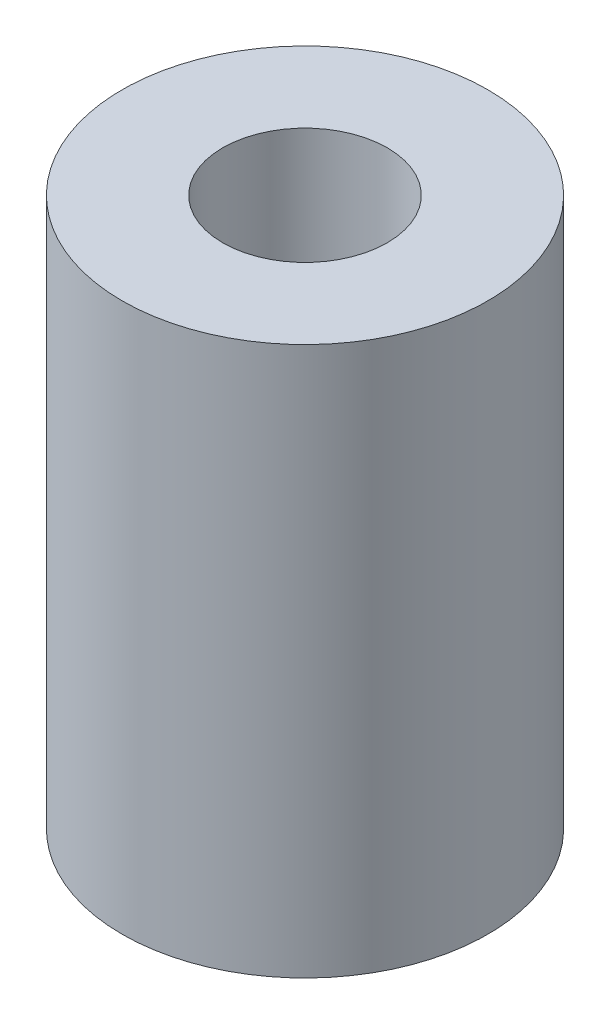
SolidWorks part; units mm, degrees
ref_plane "Plan1" through (0, 0, 0) normal (0, 0, 1) x (1, 0, 0)
ref_plane "Plan2" through (0, 0, 0) normal (0, 1, 0) x (1, 0, 0)
ref_plane "Plan3" through (0, 0, 0) normal (1, 0, 0) x (0, 0, -1)
sketch "Esquisse1" plane through (0, 0, 0) normal (0, 0, 1) x (1, 0, 0)
  line L0 (0, 0) -> (0, 94.989) construction
  line L1 (2.25, 15) -> (2.25, 0)
  line L2 (2.25, 0) -> (5, 0)
  line L3 (5, 0) -> (5, 15)
  line L4 (5, 15) -> (2.25, 15)
  dimension "D1" = 2.25
  dimension "D2" = 5
  dimension "D3" = 15
  dimension "D4" = 2.75
revolve "Base-Révolution" add sketch "Esquisse1" angle 360 about L0
